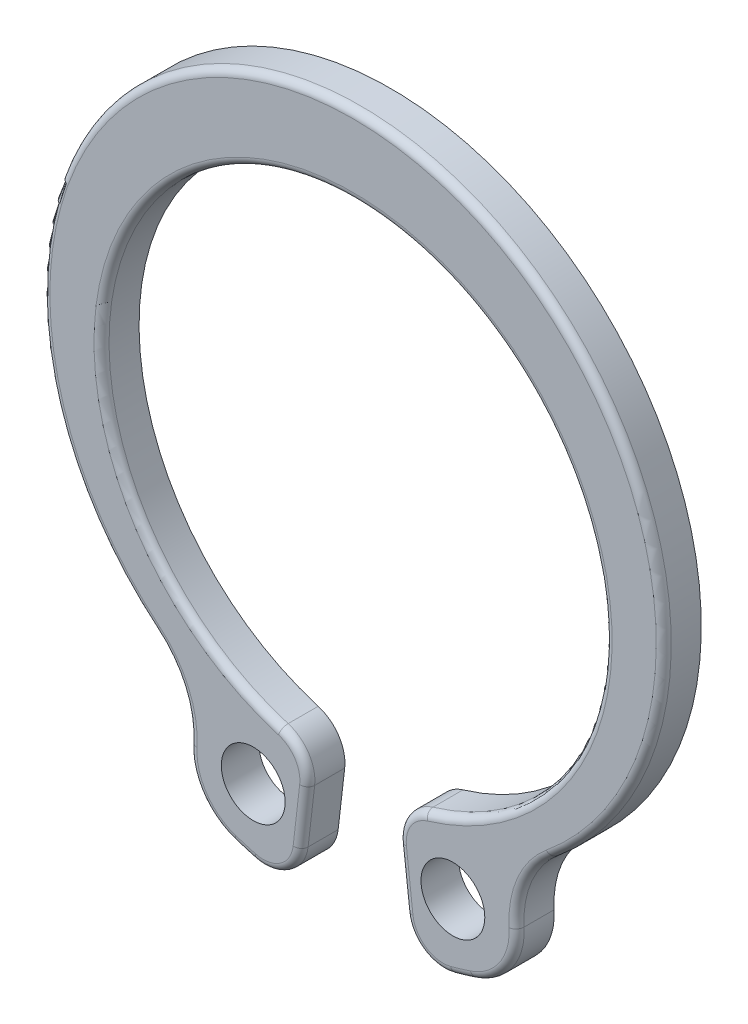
SolidWorks part; units mm, degrees
ref_plane "Face" through (0, 0, 0) normal (0, 0, 1) x (1, 0, 0)
ref_plane "Dessus" through (0, 0, 0) normal (0, 1, 0) x (1, 0, 0)
ref_plane "Droite" through (0, 0, 0) normal (1, 0, 0) x (0, 0, -1)
sketch "Esquisse1" plane through (0, 0, 0) normal (0, 0, 1) x (1, 0, 0)
  line L0 (0, 8.8) -> (0, 6.7) construction
  line L1 (1.1203, -6.6057) -> (1.5228, -10.0825)
  line L2 (-1.1203, -6.6057) -> (-1.5228, -10.0825)
  line L3 (0.34, -6.441) -> (0.34, -9.941) construction
  line L4 (-0.34, -6.441) -> (-0.34, -9.941) construction
  arc A0 (1.1203, -6.6057) -> (-1.1203, -6.6057) centre (0, 0) ccw
  arc A1 (5.2755, -5.8503) -> (-5.2755, -5.8503) centre (0, 0.525) ccw
  arc A2 (1.5228, -10.0825) -> (3.1909, -9.6847) centre (0, 0) ccw
  circle A3 centre (2.6589, -8.0701) radius 0.85
  arc A4 (3.1909, -9.6847) -> (4.3558, -7.968) centre (2.6589, -8.0701) ccw
  arc A5 (5.2755, -5.8503) -> (4.3558, -7.968) centre (6.9012, -7.8149) ccw
  circle A6 centre (-2.6589, -8.0701) radius 0.85
  arc A7 (-5.2755, -5.8503) -> (-4.3558, -7.968) centre (-6.9012, -7.8149) cw
  arc A8 (-3.1909, -9.6847) -> (-4.3558, -7.968) centre (-2.6589, -8.0701) cw
  arc A9 (-1.5228, -10.0825) -> (-3.1909, -9.6847) centre (0, 0) cw
  arc A10 (0.34, -6.441) -> (-0.34, -6.441) centre (0, 0) ccw construction
  circle A11 centre (0, 0) radius 7 construction
  dimension "dgorge" = 13.4
  dimension "D3" = 0.525
  dimension "dtrou" = 1.7
  dimension "D8" = 1.7
  dimension "D9" = 2.55
  dimension "dint" = 12.9
  dimension "dn" = 14
  dimension "b" = 2.1
  dimension "a" = 3.5
  dimension "D5" = 19.251
  dimension "D7" = 1.36
  dimension "D12" = 0.68
  dimension "D13" = 6.043
  dimension "D14" = 6.604
extrude "Base-Extrusion" add sketch "Esquisse1" along normal blind 1
fillet "Congé1" radius 1 4 edges at (1.5228, -10.0825, 0.5) (-1.5228, -10.0825, 0.5) (1.1203, -6.6057, 0.5) (-1.1203, -6.6057, 0.5)
fillet "Congé2" radius 0.2 14 edges at (-1.3805, -6.8247, 1) (-1.3098, -8.2425, 1) (-1.8287, -9.7082, 1) (-2.9217, -9.7693, 1) (-4.0656, -9.0247, 1) (-4.5623, -6.7991, 1) (0, 8.8, 1) (4.5623, -6.7991, 1) (4.0656, -9.0247, 1) (2.9217, -9.7693, 1) (1.8287, -9.7082, 1) (1.3098, -8.2425, 1) (1.3805, -6.8247, 1) (0, 6.7, 1)
equation "\"D3@Esquisse1\" = \"b@Esquisse1\"/4"
equation "\"D7@Esquisse1\"=\"dtrou@Esquisse1\"*0.8"
equation "\"D8@Esquisse1\" = \"dtrou@Esquisse1\""
equation "\"D9@Esquisse1\" = \"dtrou@Esquisse1\"*1.5"
equation "\"D12@Esquisse1\" = \"dtrou@Esquisse1\"*0.4"
equation "\"D5@Esquisse1\" = 360-(360-\"D13@Esquisse1\")*\"dint@Esquisse1\"/\"dgorge@Esquisse1\""
equation "\"D14@Esquisse1\" = (\"D5@Esquisse1\"-\"D13@Esquisse1\")/2"
